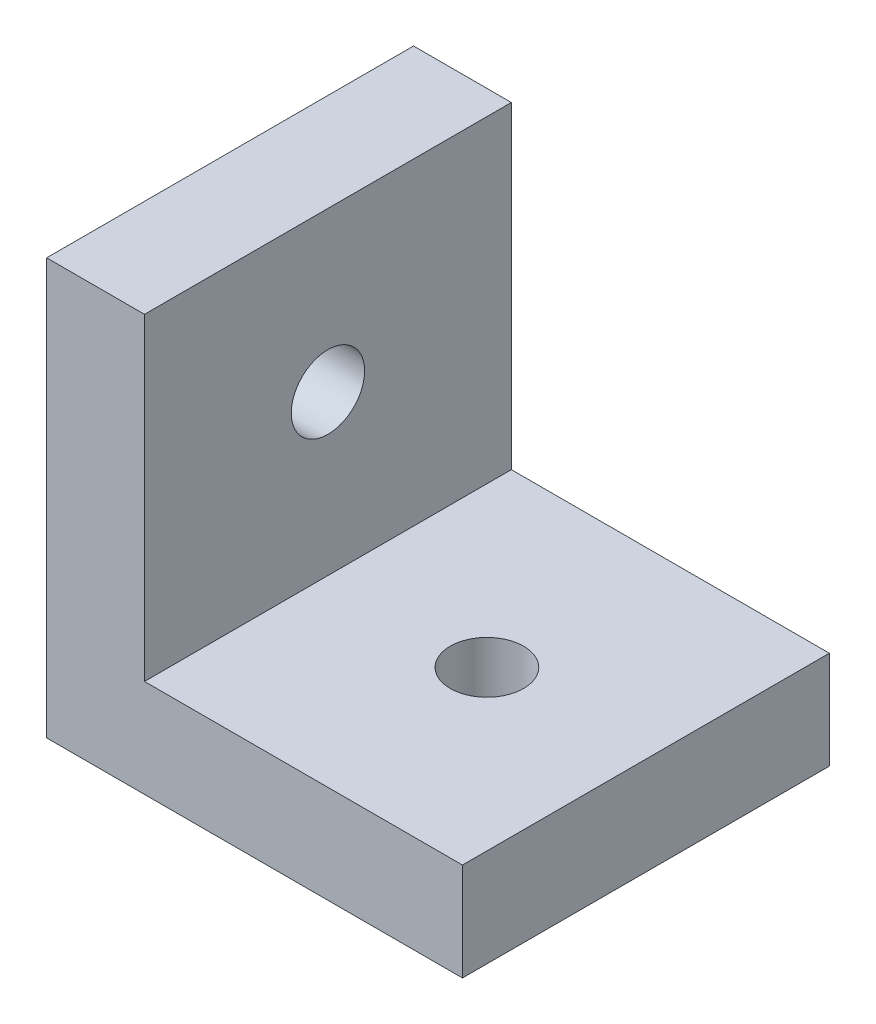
SolidWorks part; units mm, degrees
ref_plane "Plan de face" through (0, 0, 0) normal (0, 0, 1) x (1, 0, 0)
ref_plane "Plan de dessus" through (0, 0, 0) normal (0, 1, 0) x (1, 0, 0)
ref_plane "Plan de droite" through (0, 0, 0) normal (1, 0, 0) x (0, 0, -1)
sketch "Esquisse1" plane through (0, 0, 0) normal (0, 0, 1) x (1, 0, 0)
  line L0 (0, 0) -> (17, 0)
  line L1 (0, 0) -> (0, 17)
  line L2 (0, 17) -> (4, 17)
  line L3 (17, 0) -> (17, 4)
  line L4 (4, 17) -> (4, 4)
  line L5 (4, 4) -> (17, 4)
  dimension "D1" = 17
  dimension "D2" = 17
  dimension "D3" = 4
  dimension "D4" = 4
extrude "Boss.-Extru.1" add sketch "Esquisse1" along normal blind 15
sketch "Esquisse2" plane through (4, 0, 0) normal (1, 0, 0) x (0, 0, -1)
  circle A0 centre (-7.5, 10.5) radius 1.5
  dimension "D1" = 3
extrude "Enlèv. mat.-Extru.1" cut sketch "Esquisse2" against normal blind 15
sketch "Esquisse3" plane through (0, 4, 0) normal (0, 1, 0) x (1, 0, 0)
  circle A0 centre (10.5, -7.5) radius 1.5
  dimension "D1" = 3
extrude "Enlèv. mat.-Extru.2" cut sketch "Esquisse3" against normal blind 15
